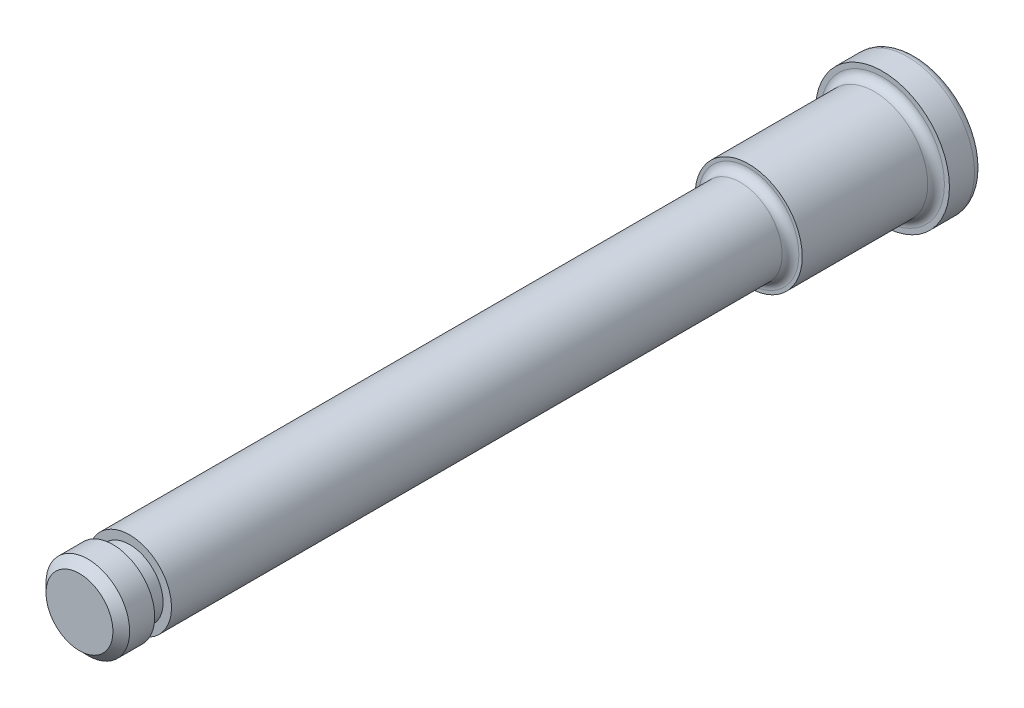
SolidWorks part; units mm, degrees
ref_plane "Plan1" through (0, 0, 0) normal (0, 0, 1) x (1, 0, 0)
ref_plane "Plan2" through (0, 0, 0) normal (0, 1, 0) x (1, 0, 0)
ref_plane "Plan3" through (0, 0, 0) normal (1, 0, 0) x (0, 0, -1)
sketch "Esquisse1" plane through (0, 0, 0) normal (0, 0, 1) x (1, 0, 0)
  circle A0 centre (0, 0) radius 4
  dimension "D1" = 8
extrude "Base-Extrusion" add sketch "Esquisse1" along normal blind 2
sketch "Esquisse2" plane through (0, 0, 2) normal (0, 0, 1) x (1, 0, 0)
  circle A0 centre (0, 0) radius 3.2
  dimension "D1" = 6.4
extrude "Boss.-Extru.1" add sketch "Esquisse2" along normal blind 8
sketch "Esquisse3" plane through (0, 0, 10) normal (0, 0, 1) x (1, 0, 0)
  circle A0 centre (0, 0) radius 2.5
  dimension "D1" = 5
extrude "Boss.-Extru.2" add sketch "Esquisse3" along normal blind 40
fillet "Congé1" radius 0.5
chamfer "Chanfrein1" distance 0.5 angle 45
sketch "Esquisse4" plane through (0, 0, 0) normal (1, 0, 0) x (0, 0, -1)
  line L0 (-50, 2) -> (-50, -2) construction
  line L1 (-48, 2) -> (-47, 2)
  line L2 (-48, 2) -> (-48, 2.5)
  line L3 (-48, 2.5) -> (-47, 2.5)
  line L4 (-47, 2) -> (-47, 2.5)
  line L5 (-10.5, 2.5) -> (-49.5, 2.5) construction
  line L6 (0, 0) -> (-52.5315, 0) construction
  line L7 (-2, 0) -> (-0.5, 0) construction
  dimension "D1" = 2
  dimension "D2" = 1
  dimension "D3" = 0.5
revolve "Enlèvement de matière-Révolution1" cut sketch "Esquisse4" angle 360 about L6
